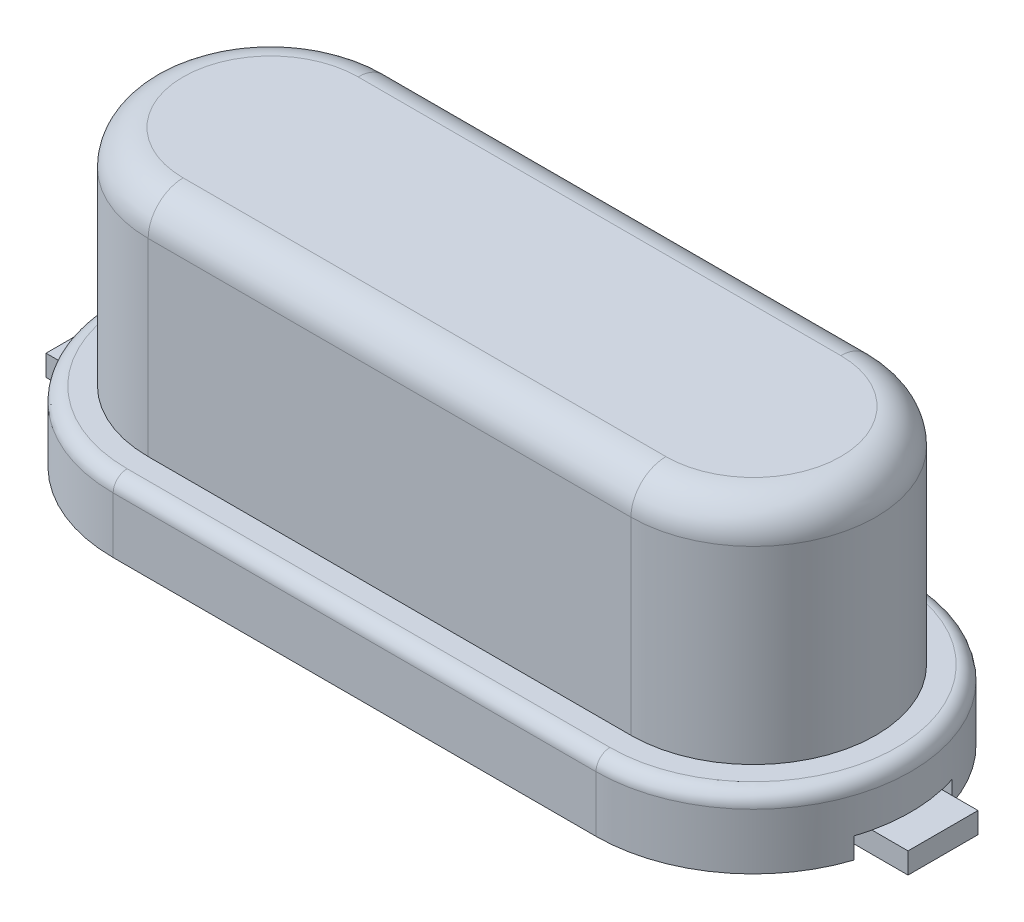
SolidWorks part; units mm, degrees
ref_plane "Front" through (0, 0, 0) normal (0, 0, 1) x (1, 0, 0)
ref_plane "Top" through (0, 0, 0) normal (0, 1, 0) x (1, 0, 0)
ref_plane "Right" through (0, 0, 0) normal (1, 0, 0) x (0, 0, -1)
sketch "Эскиз1" plane through (0, 0, 0) normal (0, 1, 0) x (1, 0, 0)
  line L0 (0, 0.5) -> (0, -0.5) construction
  line L1 (-6.16, -0.5) -> (-1.84, -0.5)
  line L2 (-6.16, -0.5) -> (-6.16, 0.5)
  line L3 (-6.16, 0.5) -> (-1.84, 0.5)
  line L4 (-1.84, -0.5) -> (-1.84, 0.5)
  line L5 (1.84, -0.5) -> (1.84, 0.5)
  line L6 (6.16, 0.5) -> (1.84, 0.5)
  line L7 (6.16, -0.5) -> (6.16, 0.5)
  line L8 (6.16, -0.5) -> (1.84, -0.5)
  line L10 (-4, -0.5) -> (-4, 0.5) construction
  line L11 (4, -0.5) -> (4, 0.5) construction
  dimension "D1" = 1
  dimension "D2" = 8
  dimension "D3" = 4.32
  dimension "D4" = 3.68
  dimension "D5" = 12.32
extrude "Вытянуть1" add sketch "Эскиз1" along normal blind 0.3
sketch "Эскиз2" plane through (0, 0, 0) normal (0, 1, 0) x (1, 0, 0)
  line L0 (1.64, 0.7) -> (1.64, -0.7)
  line L1 (1.64, -0.7) -> (5.5883, -0.7)
  line L2 (1.64, -0.7) -> (6.36, -0.7) construction
  line L3 (5.5883, 0.7) -> (1.64, 0.7)
  line L4 (1.84, 0.5) -> (1.84, -0.5)
  line L5 (6.16, 0.5) -> (1.84, 0.5)
  line L6 (6.16, -0.5) -> (6.16, 0.5)
  line L7 (1.84, -0.5) -> (6.16, -0.5)
  line L8 (1.84, 0.5) -> (1.84, -0.5) construction
  line L9 (6.16, 0.5) -> (1.84, 0.5) construction
  line L10 (6.16, -0.5) -> (6.16, 0.5) construction
  line L11 (1.84, -0.5) -> (6.16, -0.5) construction
  line L12 (-6.16, -0.5) -> (-1.84, -0.5)
  line L13 (-1.84, -0.5) -> (-1.84, 0.5)
  line L14 (-1.84, 0.5) -> (-6.16, 0.5)
  line L15 (-6.16, 0.5) -> (-6.16, -0.5)
  line L16 (-6.16, -0.5) -> (-1.84, -0.5) construction
  line L17 (-1.84, -0.5) -> (-1.84, 0.5) construction
  line L18 (-1.84, 0.5) -> (-6.16, 0.5) construction
  line L19 (-6.16, 0.5) -> (-6.16, -0.5) construction
  line L20 (-5.5883, -0.7) -> (-1.64, -0.7)
  line L21 (-1.64, -0.7) -> (-1.64, 0.7)
  line L22 (-1.64, 0.7) -> (-5.5883, 0.7)
  line L23 (-6.36, -0.7) -> (-1.64, -0.7) construction
  line L24 (0, 0.5) -> (0, -0.5) construction
  line L25 (-3.45, 0) -> (3.45, 0) construction
  line L27 (-3.45, -2.25) -> (3.45, -2.25)
  line L28 (-3.45, 2.25) -> (3.45, 2.25)
  line L29 (0, 1.8064) -> (0, -2.0954) construction
  line L30 (-1.64, 0.7) -> (-6.36, 0.7) construction
  line L31 (-6.36, 0.7) -> (-6.36, -0.7) construction
  line L32 (6.36, 0.7) -> (1.64, 0.7) construction
  line L33 (6.36, -0.7) -> (6.36, 0.7) construction
  arc A0 (-3.45, -2.25) -> (-5.5883, -0.7) centre (-3.45, 0) cw
  arc A1 (3.45, -2.25) -> (5.5883, -0.7) centre (3.45, 0) ccw
  arc A2 (-5.5883, 0.7) -> (-3.45, 2.25) centre (-3.45, 0) cw
  arc A3 (5.5883, 0.7) -> (3.45, 2.25) centre (3.45, 0) ccw
  point P18 (0, 0)
  dimension "D6" = 11.4
  dimension "D1" = 0
  dimension "D2" = 0
  dimension "D3" = 0.2
  dimension "D4" = 2.25
  dimension "D5" = 2.25
extrude "Вытянуть2" add sketch "Эскиз2" along normal blind 0.3
sketch "Эскиз3" plane through (0, 0.3, 0) normal (0, 1, 0) x (-1, 0, 0)
  line L8 (-3.45, -2.25) -> (3.45, -2.25)
  line L9 (5.5883, -0.7) -> (1.64, -0.7)
  line L10 (1.64, -0.7) -> (1.64, 0.7)
  line L11 (1.64, 0.7) -> (5.5883, 0.7)
  line L12 (3.45, 2.25) -> (-3.45, 2.25)
  line L13 (-5.5883, 0.7) -> (-1.64, 0.7)
  line L14 (-1.64, 0.7) -> (-1.64, -0.7)
  line L15 (-1.64, -0.7) -> (-5.5883, -0.7)
  line L16 (-3.45, -2.25) -> (3.45, -2.25)
  line L20 (3.45, 2.25) -> (-3.45, 2.25)
  arc A4 (-5.5883, -0.7) -> (-3.45, -2.25) centre (-3.45, 0) ccw
  arc A5 (3.45, -2.25) -> (5.5883, -0.7) centre (3.45, 0) ccw
  arc A6 (5.5883, 0.7) -> (3.45, 2.25) centre (3.45, 0) ccw
  arc A7 (-3.45, 2.25) -> (-5.5883, 0.7) centre (-3.45, 0) ccw
  arc A8 (-3.45, 2.25) -> (-3.45, -2.25) centre (-3.45, 0) ccw
  arc A9 (3.45, -2.25) -> (3.45, 2.25) centre (3.45, 0) ccw
  dimension "D1" = 0
extrude "Вытянуть3" add sketch "Эскиз3" along normal blind 0.7
sketch "Эскиз4" plane through (0, 1, 0) normal (0, 1, 0) x (-1, 0, 0)
  line L0 (-3.45, -1.75) -> (3.45, -1.75)
  line L1 (3.45, 1.75) -> (-3.45, 1.75)
  line L2 (-3.45, -2.25) -> (3.45, -2.25)
  line L3 (3.45, 2.25) -> (-3.45, 2.25)
  line L4 (-3.45, -2.25) -> (3.45, -2.25) construction
  line L5 (3.45, 2.25) -> (-3.45, 2.25) construction
  arc A0 (3.45, -1.75) -> (3.45, 1.75) centre (3.45, 0) ccw
  arc A1 (-3.45, 1.75) -> (-3.45, -1.75) centre (-3.45, 0) ccw
  arc A2 (3.45, -2.25) -> (3.45, 2.25) centre (3.45, 0) ccw
  arc A3 (-3.45, 2.25) -> (-3.45, -2.25) centre (-3.45, 0) ccw
  arc A4 (3.45, -2.25) -> (3.45, 2.25) centre (3.45, 0) ccw construction
  arc A5 (-3.45, 2.25) -> (-3.45, -2.25) centre (-3.45, 0) ccw construction
  dimension "D4" = 10.4
  dimension "D3" = 3.5
  dimension "D1" = 0
  dimension "D2" = 0.5
extrude "Вытянуть4" add sketch "Эскиз4" along normal offset from surface (3.2 mm away) 4.2
fillet "Скругление1" radius 0.2 4 edges at (-5.7, 1, 0) (0, 1, -2.25) (5.7, 1, 0) (0, 1, 2.25)
fillet "Скругление2" radius 0.5 4 edges at (0, 4.2, 1.75) (-5.2, 4.2, 0) (0, 4.2, -1.75) (5.2, 4.2, 0)
